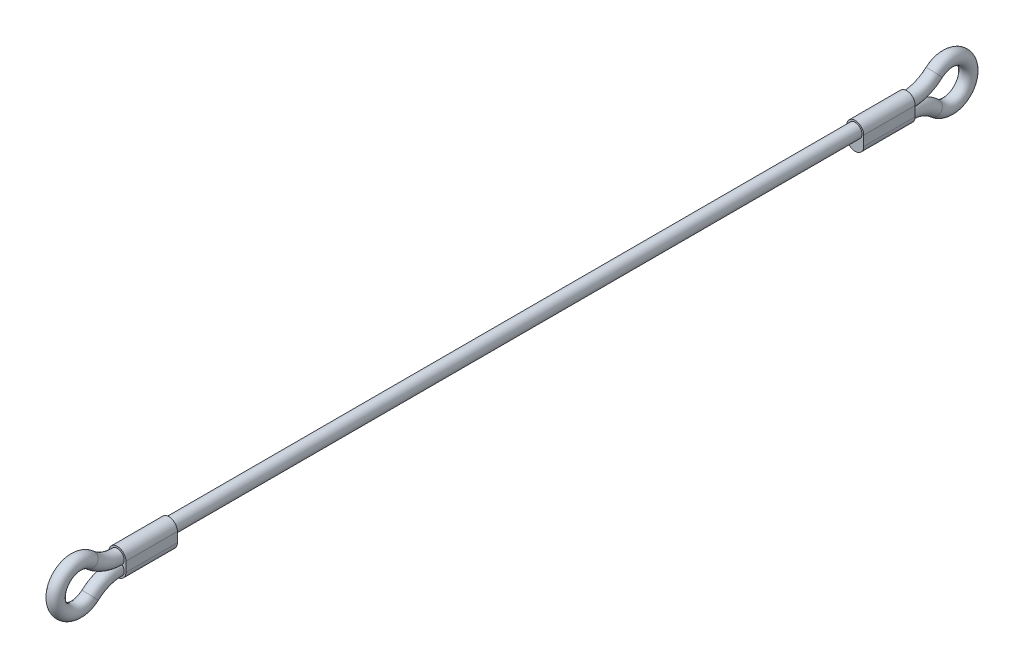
SolidWorks part; units mm, degrees
ref_plane "Front Plane" through (0, 0, 0) normal (0, 0, 1) x (1, 0, 0)
ref_plane "Top Plane" through (0, 0, 0) normal (0, 1, 0) x (1, 0, 0)
ref_plane "Right Plane" through (0, 0, 0) normal (1, 0, 0) x (0, 0, -1)
sketch "Sketch1" plane through (0, 0, 0) normal (1, 0, 0) x (0, 0, -1)
  line L0 (92, 0) -> (-92, 0)
  line L1 (0, 2.1945) -> (0, -2.1945) construction
  arc A0 (-92, 0) -> (-98.4, 2.4446) centre (-92, 9.6) cw
  arc A1 (-98.4, 2.4446) -> (-98.4, -4.7108) centre (-101.6, -1.1331) ccw
  arc A2 (-98.4, -4.7108) -> (-92, -2.2663) centre (-92, -11.8663) cw
  arc A3 (98.4, -4.7108) -> (92, -2.2663) centre (92, -11.8663) ccw
  arc A4 (98.4, 2.4446) -> (98.4, -4.7108) centre (101.6, -1.1331) cw
  arc A5 (92, 0) -> (98.4, 2.4446) centre (92, 9.6) ccw
  point P18 (0, 0)
  dimension "D1" = 4.8
  dimension "D4" = 9.6
  dimension "D2" = 101.6
  dimension "D3" = 9.6
sketch "Sketch2" plane through (0, 0, 0) normal (0, 0, 1) x (1, 0, 0)
  circle A0 centre (0, 0) radius 1.59
  dimension "D1" = 3.18
sweep "Sweep1" add profiles "Sketch2" path "Sketch1"
sketch "Sketch3" plane through (0, 0, 92) normal (0, 0, -1) x (-1, 0, 0)
  line L0 (0, 0) -> (0, -2.2663) construction
  line L1 (1.995, 0) -> (1.995, -2.2663)
  line L2 (-1.995, 0) -> (-1.995, -2.2663)
  line L3 (-1.59, -2.2663) -> (1.59, -2.2663) construction
  arc A0 (1.995, 0) -> (-1.995, 0) centre (0, 0) ccw
  arc A1 (-1.995, -2.2663) -> (1.995, -2.2663) centre (0, -2.2663) ccw
  point P3 (0, -1.1331)
  dimension "D1" = 3.99
extrude "Boss-Extrude1" add sketch "Sketch3" along normal blind 12
mirror "Mirror1" about plane through (0, 0, 0) normal (0, 0, 1) of "Boss-Extrude1"
